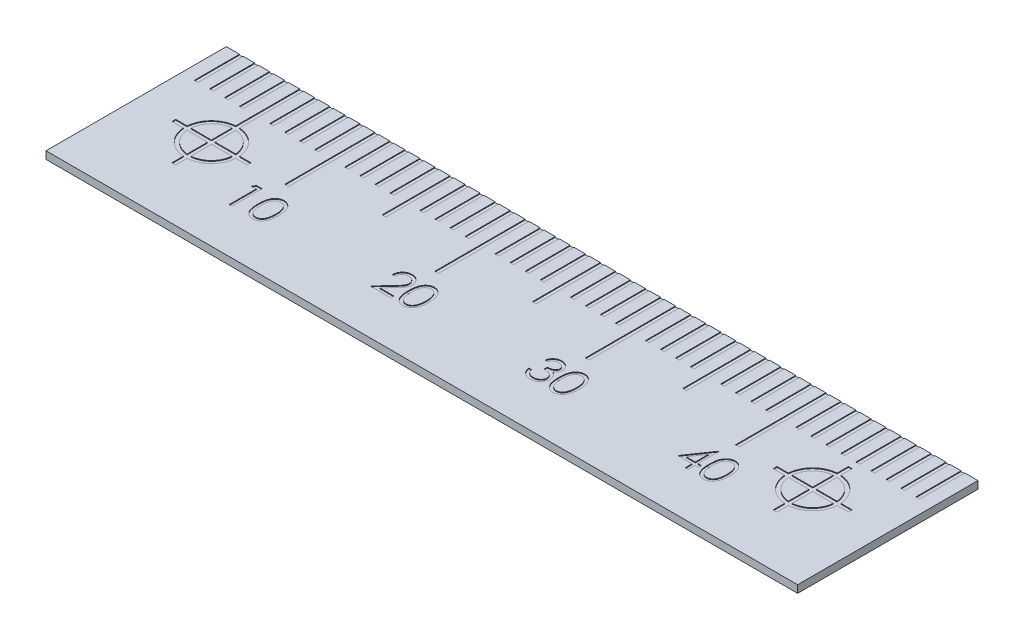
SolidWorks part; units mm, degrees
ref_plane "Front Plane" through (0, 0, 0) normal (0, 0, 1) x (1, 0, 0)
ref_plane "Top Plane" through (0, 0, 0) normal (0, 1, 0) x (1, 0, 0)
ref_plane "Right Plane" through (0, 0, 0) normal (1, 0, 0) x (0, 0, -1)
sketch "Sketch1" plane through (0, 0, 0) normal (0, 1, 0) x (1, 0, 0)
  line L1 (-25, 6) -> (25, 6)
  line L2 (-25, 6) -> (-25, -6)
  line L3 (-25, -6) -> (25, -6)
  line L4 (25, 6) -> (25, -6)
extrude "Boss-Extrude1" add sketch "Sketch1" against normal blind 0.5
sketch "Sketch2" plane through (0, 0, 0) normal (0, 1, 0) x (1, 0, 0)
  line L1 (-24.125, 3) -> (-23.875, 3)
  line L2 (-24.125, 3) -> (-24.125, 6)
  line L3 (-24.125, 6) -> (-23.875, 6)
  line L4 (-23.875, 3) -> (-23.875, 6)
  line L5 (-24, 6) -> (-24, 3) construction
  line L6 (-25, 6) -> (-25, -6) construction
  dimension "D1" = 3
  dimension "D2" = 0.25
  dimension "D3" = 1
extrude "Cut-Extrude2" cut sketch "Sketch2" against normal blind 0.05 contours L4 L3 L2 L1
pattern_linear "LPattern2" count 49 spacing 1 along (1, 0, 0) of "Cut-Extrude2"
sketch "Sketch3" plane through (0, 0, 0) normal (0, 1, 0) x (1, 0, 0)
  line L0 (-15.125, 3) -> (-15.125, 6) construction
  line L6 (-15.125, 3) -> (-14.875, 3)
  line L7 (-15.125, 3) -> (-15.125, 0)
  line L8 (-15.125, 0) -> (-14.875, 0)
  line L9 (-14.875, 3) -> (-14.875, 0)
  dimension "D1" = 0
  dimension "D2" = 0.25
  dimension "D4" = 3
extrude "Cut-Extrude3" cut sketch "Sketch3" against normal blind 0.05
pattern_linear "LPattern3" count 4 spacing 10 along (1, 0, 0) of "Cut-Extrude3"
sketch "Sketch4" plane through (0, 0, 0) normal (0, 1, 0) x (1, 0, 0)
  line L0 (-10.125, 3) -> (-10.125, 6) construction
  line L1 (-10.125, 3) -> (-9.875, 3)
  line L2 (-10.125, 3) -> (-10.125, 1.5)
  line L3 (-10.125, 1.5) -> (-9.875, 1.5)
  line L4 (-9.875, 3) -> (-9.875, 1.5)
  dimension "D1" = 0
  dimension "D2" = 0.25
  dimension "D3" = 3
  dimension "D4" = 1.5
extrude "Cut-Extrude4" cut sketch "Sketch4" against normal blind 0.05
pattern_linear "LPattern4" count 3 spacing 10 along (1, 0, 0) count 2 spacing 10 along (-1, 0, 0) of "Cut-Extrude4"
sketch "Sketch5" plane through (0, 0, 0) normal (0, 1, 0) x (1, 0, 0)
  line L0 (-19.995, 0) -> (-19.995, 2.5) construction
  line L1 (-19.995, 0) -> (-19.995, -2.5) construction
  line L2 (-19.995, 0) -> (-17.495, 0) construction
  line L3 (-19.995, 0) -> (-22.495, 0) construction
  line L5 (-20.12, 2.5) -> (-19.87, 2.5)
  line L6 (-20.12, 2.5) -> (-20.12, 1.7455)
  line L7 (-20.12, -2.5) -> (-19.87, -2.5)
  line L8 (-19.87, 2.5) -> (-19.87, 1.7455)
  line L9 (-22.495, 0.125) -> (-21.7405, 0.125)
  line L10 (-22.495, 0.125) -> (-22.495, -0.125)
  line L11 (-22.495, -0.125) -> (-21.7405, -0.125)
  line L12 (-17.495, 0.125) -> (-17.495, -0.125)
  line L13 (-23.125, 6) -> (-23.875, 6) construction
  line L14 (-20.12, 1.4948) -> (-20.12, 0.125)
  line L15 (-19.87, 1.4948) -> (-19.87, 0.125)
  line L16 (-18.2495, 0.125) -> (-17.495, 0.125)
  line L17 (-18.2495, -0.125) -> (-17.495, -0.125)
  line L18 (-19.87, -1.7455) -> (-19.87, -2.5)
  line L19 (-20.12, -1.7455) -> (-20.12, -2.5)
  line L20 (-21.4898, -0.125) -> (-20.12, -0.125)
  line L21 (-21.4898, 0.125) -> (-20.12, 0.125)
  line L22 (-19.87, -0.125) -> (-19.87, -1.4948)
  line L23 (-19.87, 0.125) -> (-18.5002, 0.125)
  line L24 (-20.12, -0.125) -> (-20.12, -1.4948)
  line L25 (-19.87, -0.125) -> (-18.5002, -0.125)
  arc A0 (-20.12, 1.4948) -> (-21.4898, 0.125) centre (-19.995, 0) ccw
  arc A1 (-20.12, 1.7455) -> (-21.7405, 0.125) centre (-19.995, 0) ccw
  arc A2 (-18.5002, 0.125) -> (-19.87, 1.4948) centre (-19.995, 0) ccw
  arc A3 (-18.2495, 0.125) -> (-19.87, 1.7455) centre (-19.995, 0) ccw
  arc A4 (-19.87, -1.4948) -> (-18.5002, -0.125) centre (-19.995, 0) ccw
  arc A5 (-19.87, -1.7455) -> (-18.2495, -0.125) centre (-19.995, 0) ccw
  arc A6 (-21.4898, -0.125) -> (-20.12, -1.4948) centre (-19.995, 0) ccw
  arc A7 (-21.7405, -0.125) -> (-20.12, -1.7455) centre (-19.995, 0) ccw
  point P34 (-19.995, 2.5)
extrude "Cut-Extrude6" cut sketch "Sketch5" against normal blind 0.05
pattern_linear "LPattern5" count 2 spacing 40 along (1, 0, 0) of "Cut-Extrude6"
sketch "Sketch7" plane through (0, 0, 0) normal (0, 1, 0) x (1, 0, 0)
  line L0 (-25, -6) -> (25, -6) construction
  line L1 (-25, 6) -> (-25, -6) construction
  text T0 "10         20         30         40" font "Century Gothic" height 2
  dimension "D1" = 3
  dimension "D2" = 8.5
extrude "Cut-Extrude7" cut sketch "Sketch7" against normal blind 0.05
sketch "Sketch11" plane through (0, 0, 0) normal (0, 1, 0) x (1, 0, 0)
  line L0 (-25, -6) -> (25, -6) construction
  line L1 (-25, 6) -> (-25, -6) construction
  text T0 "50         60         70         80         90" font "Century Gothic" height 2
  dimension "D1" = 3
  dimension "D2" = 48.5
extrude "Cut-Extrude8" [suppressed] cut sketch "Sketch11" against normal blind 0.05
sketch "Sketch14" plane through (0, 0, 0) normal (0, 1, 0) x (1, 0, 0)
  line L0 (-25, -6) -> (25, -6) construction
  line L1 (-25, 6) -> (-25, -6) construction
  text T0 "100       110       120       130       140" font "Century Gothic" height 2
  dimension "D1" = 3
  dimension "D2" = 97.5
extrude "Cut-Extrude10" [suppressed] cut sketch "Sketch14" against normal blind 0.05
sketch "Sketch15" plane through (0, 0, 0) normal (0, 1, 0) x (1, 0, 0)
  line L0 (-25, 6) -> (-25, -6) construction
  line L1 (-25, -6) -> (25, -6) construction
  text T0 "40         30         20         10" font "Century Gothic" height 2
  dimension "D1" = 108.5
  dimension "D2" = 3
extrude "Cut-Extrude12" [suppressed] cut sketch "Sketch15" against normal blind 0.05
sketch "Sketch18" plane through (0, 0, 0) normal (0, 1, 0) x (1, 0, 0)
  line L0 (-25, -6) -> (25, -6) construction
  line L1 (-25, 6) -> (-25, -6) construction
  text T0 "90         80         70         60         50" font "Century Gothic" height 2
  dimension "D1" = 3
  dimension "D2" = 8.5
extrude "Cut-Extrude13" [suppressed] cut sketch "Sketch18" against normal blind 0.05
sketch "Sketch19" plane through (0, 0, 0) normal (0, 1, 0) x (1, 0, 0)
  line L0 (-25, 6) -> (-25, -6) construction
  line L1 (-25, -6) -> (25, -6) construction
  text T0 "140       130       120       110       100" font "Century Gothic" height 2
  dimension "D1" = 7.5
  dimension "D2" = 3
extrude "Cut-Extrude14" [suppressed] cut sketch "Sketch19" against normal blind 0.05
sketch "Sketch20" plane through (0, 0, 0) normal (0, 1, 0) x (1, 0, 0)
  circle A0 centre (-19.995, 0) radius 1.75
extrude "Cut-Extrude15" [suppressed] cut sketch "Sketch20" against normal blind 0.5
pattern_linear "LPattern6" [suppressed] count 2 spacing 40
sketch "Sketch21" plane through (0, 0, 0) normal (0, 1, 0) x (1, 0, 0)
  line L0 (-25, -6) -> (25, -6) construction
  line L1 (-25, 6) -> (-25, -6) construction
  text T0 "10         20         30         40         50         40         30         20         10" font "Century Gothic" height 2
  dimension "D1" = 3
  dimension "D2" = 8.5
extrude "Cut-Extrude17" [suppressed] cut sketch "Sketch21" against normal blind 0.05
sketch "Sketch22" plane through (0, 0, 0) normal (0, 1, 0) x (1, 0, 0)
  line L0 (-25, -6) -> (25, -6) construction
  line L1 (-25, 6) -> (-25, -6) construction
  text T0 "10         20         30         40         50         60         70         80         90        100        90         80         70         60         50         40         30         20         10" font "Century Gothic" height 2
  dimension "D1" = 3
  dimension "D2" = 8.5
extrude "Cut-Extrude18" [suppressed] cut sketch "Sketch22" against normal blind 0.05
sketch "Sketch23" plane through (0, 0, 0) normal (0, 1, 0) x (1, 0, 0)
  line L0 (-25, -6) -> (25, -6) construction
  line L2 (-25, 6) -> (-25, -6) construction
  text T0 "10         20         30         40         50         60         70         80         90        100       110       120       130       140       150       160       170       180       190       20" font "Century Gothic" height 2
  dimension "D1" = 3
  dimension "D2" = 8.5
extrude "Cut-Extrude19" [suppressed] cut sketch "Sketch23" against normal blind 0.05
sketch "Sketch24" plane through (0, 0, 0) normal (0, 1, 0) x (1, 0, 0)
  line L0 (-25, -6) -> (25, -6) construction
  line L1 (-25, 6) -> (-25, -6) construction
  text T0 "10         20         30         40         50         60         70         80         90        100       110       120       130       140       150       160       170       180       190" font "Century Gothic" height 2
  dimension "D1" = 3
  dimension "D2" = 8.5
extrude "Cut-Extrude20" [suppressed] cut sketch "Sketch24" against normal blind 0.05
sketch "Sketch26" plane through (0, 0, 0) normal (0, 1, 0) x (1, 0, 0)
  line L0 (-25, -6) -> (25, -6) construction
  line L1 (-25, 6) -> (-25, -6) construction
  text T0 "190       180       170       160       150       140       130       120       110       100        90         80         70         60         50         40         30         20         10" font "Century Gothic" height 2
  dimension "D1" = 3
  dimension "D2" = 7.5
extrude "Cut-Extrude21" [suppressed] cut sketch "Sketch26" against normal blind 0.05
sketch "Sketch27" plane through (0, 0, 0) normal (0, 1, 0) x (1, 0, 0)
  line L0 (-25, -6) -> (25, -6) construction
  line L1 (-25, 6) -> (-25, -6) construction
  text T0 "490       480       470       460       450       440       430       420       410       400       390       380       370       360       350       340       330       320       310       300       " font "Century Gothic" height 2
  dimension "D1" = 3
  dimension "D2" = 7.5
extrude "Cut-Extrude22" [suppressed] cut sketch "Sketch27" against normal blind 0.05
sketch "Sketch29" plane through (0, 0, 0) normal (0, 1, 0) x (1, 0, 0)
  line L0 (-25, -6) -> (25, -6) construction
  line L1 (-25, 6) -> (-25, -6) construction
  text T0 "10         20         30         40         50         60         70         80         90        100       110       120       130       140       150       160       170       180       190       20" font "Century Gothic" height 2
  dimension "D1" = 3
  dimension "D2" = 8.5
extrude "Cut-Extrude23" [suppressed] cut sketch "Sketch29" against normal blind 0.05
sketch "Sketch30" plane through (0, 0, 0) normal (0, 1, 0) x (1, 0, 0)
  line L0 (-25, -6) -> (25, -6) construction
  line L1 (-25, 6) -> (-25, -6) construction
  text T0 "240       230       220       210       200       190       180       170       160       150       140       130       120       110       100        90         80         70         60         50   " font "Century Gothic" height 2
  dimension "D1" = 3
  dimension "D2" = 7.5
extrude "Cut-Extrude24" [suppressed] cut sketch "Sketch30" against normal blind 0.05
sketch "Sketch31" [suppressed] plane through (0, 0, 0) normal (0, 1, 0) x (1, 0, 0)
  line L0 (-100, -6) -> (100, -6) construction
  line L1 (-100, 6) -> (-100, -6) construction
  text T0 "150       160       170       180       190" font "Century Gothic" height 2
  dimension "D1" = 3
  dimension "D2" = 148.5
extrude "Cut-Extrude25" [suppressed] cut sketch "Sketch31" against normal blind 0.05
sketch "Sketch32" [suppressed] plane through (0, 0, 0) normal (0, 1, 0) x (1, 0, 0)
  line L0 (-25, -6) -> (25, -6) construction
  line L1 (-24.125, -6) -> (-23.875, -6)
  line L2 (-24.125, -6) -> (-24.125, -3)
  line L3 (-24.125, -3) -> (-23.875, -3)
  line L4 (-23.875, -6) -> (-23.875, -3)
  line L5 (-24, -3) -> (-24, -6) construction
  line L6 (-25, 6) -> (-25, -6) construction
  dimension "D1" = 0.25
  dimension "D2" = 3
  dimension "D3" = 1
extrude "Cut-Extrude26" [suppressed] cut sketch "Sketch32" against normal blind 0.05
pattern_linear "LPattern7" [suppressed] count 99 spacing 1
sketch "Sketch34" [suppressed] plane through (0, 0, 0) normal (0, 1, 0) x (1, 0, 0)
  line L1 (-245.125, -3) -> (-244.875, -3)
  line L2 (-245.125, -3) -> (-245.125, -1.5)
  line L3 (-245.125, -1.5) -> (-244.875, -1.5)
  line L4 (-244.875, -3) -> (-244.875, -1.5)
  dimension "D1" = 1.5
  dimension "D2" = 0.25
extrude "Cut-Extrude27" [suppressed] cut sketch "Sketch34" against normal blind 0.05
pattern_linear "LPattern8" [suppressed] count 4 spacing 10
sketch "Sketch35" [suppressed] plane through (0, 0, 0) normal (0, 1, 0) x (1, 0, 0)
  line L1 (-240.125, -3) -> (-239.875, -3)
  line L2 (-240.125, -3) -> (-240.125, 0)
  line L3 (-240.125, 0) -> (-239.875, 0)
  line L4 (-239.875, -3) -> (-239.875, 0)
  dimension "D1" = 3
  dimension "D2" = 0.25
extrude "Cut-Extrude28" [suppressed] cut sketch "Sketch35" against normal blind 0.05
pattern_linear "LPattern9" [suppressed] count 4 spacing 10
equation "\"D2@Sketch1\"=\"D1@Sketch1\"/2"
equation "\"D4@Sketch1\"=\"D3@Sketch1\"/2"
equation "\"D8@Sketch5\"=\"D7@Sketch5\"/2"
equation "\"D10@Sketch5\"=\"D9@Sketch5\"/2"
